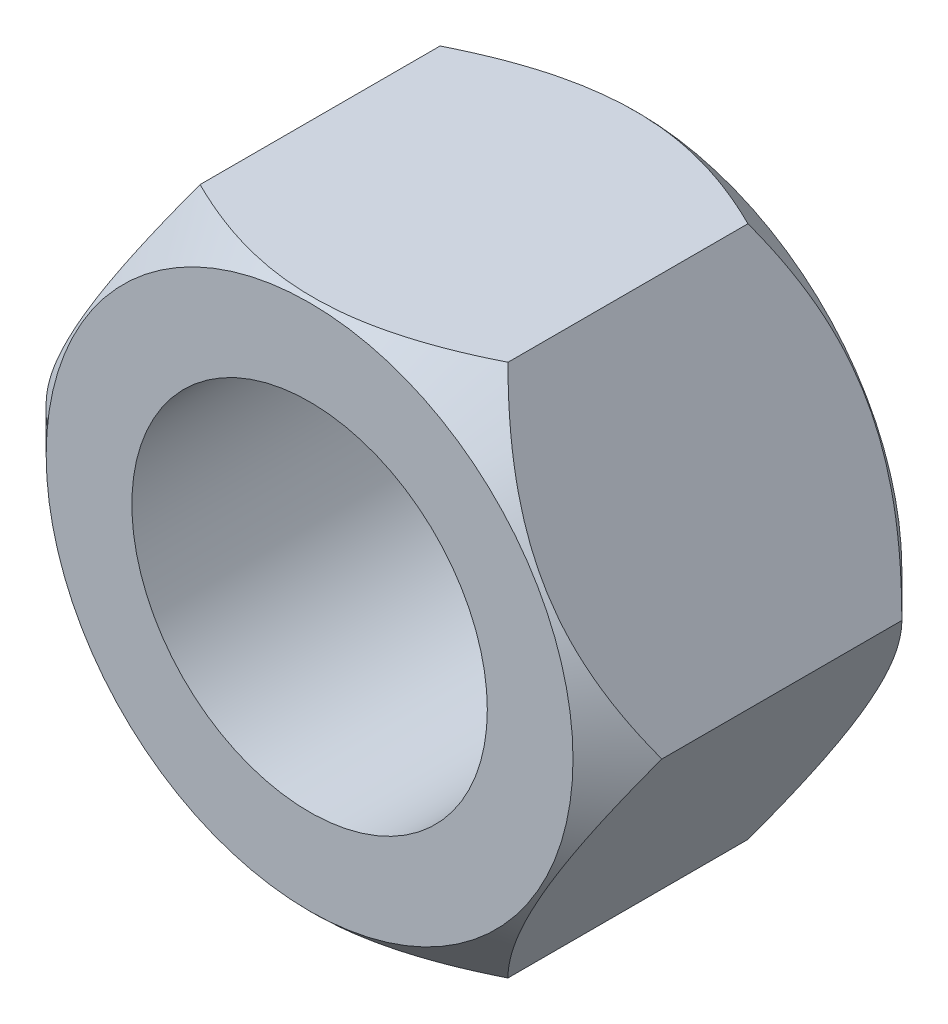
SolidWorks part; units mm, degrees
ref_plane "Plan de face" through (0, 0, 0) normal (0, 0, 1) x (1, 0, 0)
ref_plane "Plan de dessus" through (0, 0, 0) normal (0, 1, 0) x (1, 0, 0)
ref_plane "Plan de droite" through (0, 0, 0) normal (1, 0, 0) x (0, 0, -1)
sketch "Esquisse1" plane through (0, 0, 0) normal (0, 0, 1) x (1, 0, 0)
  line L1 (13.8564, 0) -> (6.9282, 12)
  line L2 (6.9282, 12) -> (-6.9282, 12)
  line L3 (-6.9282, 12) -> (-13.8564, 0)
  line L4 (-13.8564, 0) -> (-6.9282, -12)
  line L5 (-6.9282, -12) -> (6.9282, -12)
  line L6 (6.9282, -12) -> (13.8564, 0)
  circle A0 centre (0, 0) radius 12 construction
  dimension "D1" = 24
extrude "Boss.-Extru.1" add sketch "Esquisse1" along normal mid plane 14.8
sketch "Esquisse2" plane through (0, 0, 7.4) normal (0, 0, 1) x (1, 0, 0)
  circle A0 centre (0, 0) radius 8
  dimension "D1" = 16
extrude "Enlèv. mat.-Extru.1" cut sketch "Esquisse2" against normal through all
sketch "Esquisse3" plane through (0, 0, 0) normal (0, 1, 0) x (1, 0, 0)
  line L0 (13.8564, 7.4) -> (11.8564, 7.4)
  line L1 (13.8564, 7.4) -> (6.9282, 7.4) construction
  line L2 (11.8564, 7.4) -> (13.8564, 5.4)
  line L3 (13.8564, -7.4) -> (13.8564, 7.4) construction
  line L4 (13.8564, 5.4) -> (13.8564, 7.4)
  line L5 (0, 0) -> (0, 8.9562) construction
  dimension "D1" = 2
  dimension "D2" = 2
revolve "Enlèvement de matière-Révolution1" cut sketch "Esquisse3" angle 360 about L5
mirror "Symétrie1" about plane through (0, 0, 0) normal (0, 0, 1) of "Enlèvement de matière-Révolution1"
